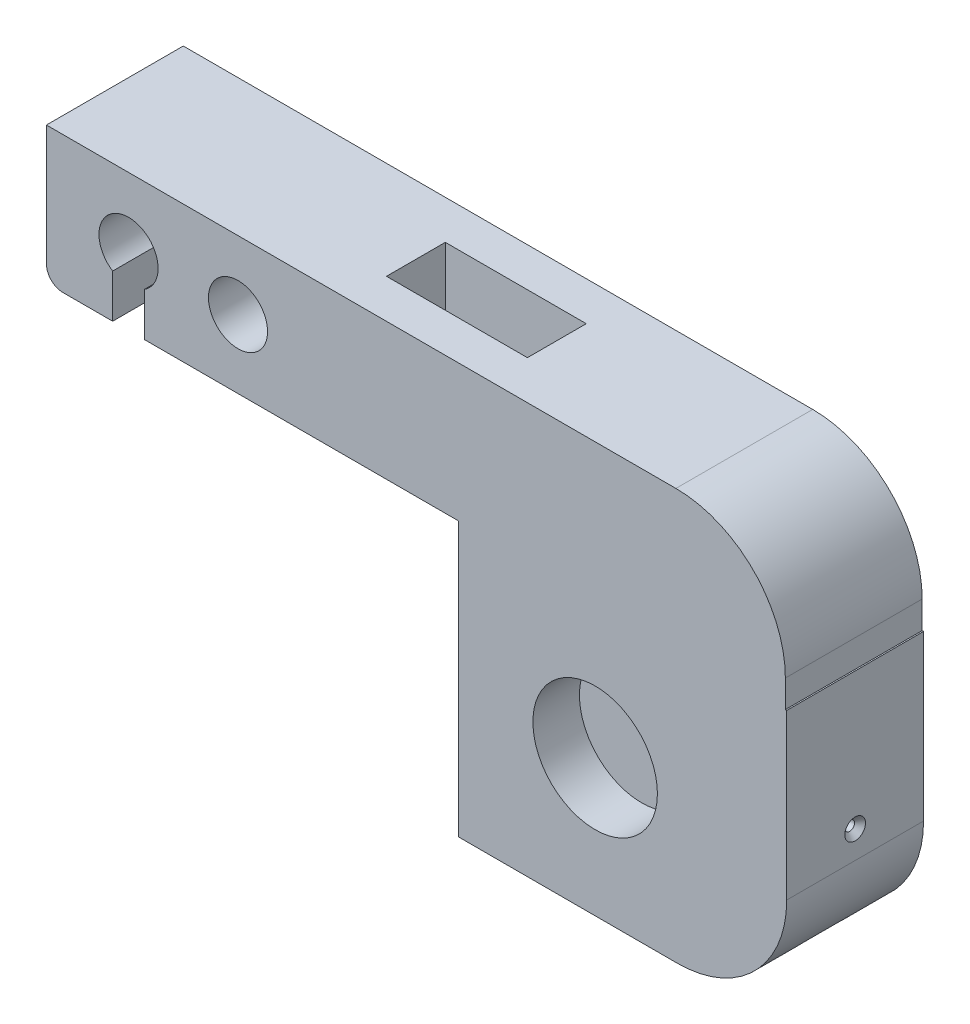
SolidWorks part; units mm, degrees
ref_plane "Front Plane" through (0, 0, 0) normal (0, 0, 1) x (1, 0, 0)
ref_plane "Top Plane" through (0, 0, 0) normal (0, 1, 0) x (1, 0, 0)
ref_plane "Right Plane" through (0, 0, 0) normal (1, 0, 0) x (0, 0, -1)
sketch "Sketch1" plane through (0, 0, 0) normal (0, 0, 1) x (1, 0, 0)
  line L0 (-122.9, 0) -> (-122.9, 7.9448)
  line L1 (0, 0) -> (-135, 0)
  line L2 (0, 0) -> (0, 25)
  line L3 (0, 25) -> (-135, 25)
  line L4 (-135, 0) -> (-135, 25)
  line L5 (-117.1, 0) -> (-117.1, 7.9448)
  circle A0 centre (-120, 12.5) radius 5.4
  circle A1 centre (-100, 12.5) radius 5.4
  dimension "D3" = 15
  dimension "D4" = 12.5
  dimension "D5" = 12.5
  dimension "D6" = 10.8
  dimension "D7" = 35
  dimension "D1" = 25
  dimension "D2" = 135
  dimension "D8" = 5.8
extrude "Boss-Extrude1" add sketch "Sketch1" along normal blind 25 contours A0 L5 L1 L2 L3 L4 L0 A1
sketch "Sketch2" plane through (0, 25, 0) normal (0, 1, 0) x (1, 0, 0)
  line L0 (-69.875, -17.875) -> (-69.875, -25) construction
  line L1 (-80, -7.125) -> (-59.75, -7.125)
  line L2 (-80, -7.125) -> (-80, -17.875)
  line L3 (-80, -17.875) -> (-59.75, -17.875)
  line L4 (-59.75, -7.125) -> (-59.75, -17.875)
  line L5 (0, -25) -> (-135, -25) construction
  line L6 (-69.875, -7.125) -> (-69.875, 0) construction
  line L7 (0, 0) -> (-135, 0) construction
  line L8 (-135, -25) -> (-135, 0) construction
  dimension "D1" = 10.75
  dimension "D2" = 20.25
  dimension "D3" = 55
extrude "Cut-Extrude1" cut sketch "Sketch2" against normal up to surface (25 mm away)
sketch "Sketch3" plane through (0, 0, 0) normal (0, -1, 0) x (1, 0, 0)
  line L0 (0, 25) -> (-117.1, 25) construction
  line L1 (-59.75, 25) -> (0.25, 25)
  line L2 (-59.75, 25) -> (-59.75, 0)
  line L3 (-59.75, 0) -> (0.25, 0)
  line L4 (0.25, 25) -> (0.25, 0)
  line L5 (0, 0) -> (-117.1, 0) construction
  line L6 (-59.75, 17.875) -> (-59.75, 7.125) construction
  dimension "D1" = 60
extrude "Boss-Extrude2" add sketch "Sketch3" along normal blind 50
sketch "Sketch4" plane through (0, -50, 0) normal (0, -1, 0) x (1, 0, 0)
  line L0 (-59.75, 25) -> (-59.75, 0) construction
  line L1 (-59.75, 8.5) -> (-4.75, 8.5)
  line L2 (-59.75, 8.5) -> (-59.75, 16.5)
  line L3 (-59.75, 16.5) -> (-4.75, 16.5)
  line L4 (-4.75, 8.5) -> (-4.75, 16.5)
  line L5 (-32.25, 16.5) -> (-32.25, 25) construction
  line L6 (0.25, 25) -> (-59.75, 25) construction
  line L7 (-32.25, 8.5) -> (-32.25, 0) construction
  line L8 (-59.75, 0) -> (0.25, 0) construction
  dimension "D1" = 8
  dimension "D2" = 55
extrude "Cut-Extrude2" cut sketch "Sketch4" against normal offset from surface (49 mm away) 1
sketch "Sketch5" plane through (0, 0, 25) normal (0, 0, 1) x (1, 0, 0)
  line L0 (-59.75, -50) -> (-59.75, 0) construction
  line L1 (0.25, -50) -> (-59.75, -50) construction
  circle A0 centre (-34.75, -25) radius 11.375
  dimension "D1" = 22.75
  dimension "D2" = 25
  dimension "D3" = 25
extrude "Cut-Extrude3" cut sketch "Sketch5" against normal up to surface (25 mm away) contours A0
sketch "Sketch6" plane through (0, -1, 0) normal (0, -1, 0) x (1, 0, 0)
  line L1 (-59.75, 17.875) -> (-54.25, 17.875)
  line L2 (-59.75, 17.875) -> (-59.75, 7.125)
  line L3 (-59.75, 7.125) -> (-54.25, 7.125)
  line L4 (-54.25, 17.875) -> (-54.25, 7.125)
  line L5 (-80, 17.875) -> (-59.75, 17.875) construction
  line L6 (-59.75, 7.125) -> (-80, 7.125) construction
  line L7 (-59.75, 25) -> (-59.75, 17.875) construction
  dimension "D1" = 5.5
extrude "Cut-Extrude4" cut sketch "Sketch6" against normal through all both and the other way through all
ref_plane "Plane1" through (-59.75, -50, 25) normal (0, 0, -1) x (-1, 0, 0)
sketch "Sketch8" plane through (0.25, 0, 0) normal (1, 0, 0) x (0, 0, -1)
  line L0 (-12.5, -25) -> (-25, -25) construction
  line L1 (-25, -50) -> (-25, 0) construction
  line L2 (-12.5, -25) -> (0, -25) construction
  line L3 (0, -50) -> (0, 0) construction
  circle A0 centre (-12.5, -25) radius 0.89
  point P9 (-25, -25)
  dimension "D1" = 1.78
extrude "Cut-Extrude6" cut sketch "Sketch8" against normal up to surface (5 mm away) contours A0
chamfer "Chamfer1" distance 1 angle 45 1 edges at (0.25, -25, 11.61)
fillet "Fillet1" radius 20 2 edges at (0.25, -50, 12.5) (0, 25, 12.5)
fillet "Fillet2" radius 3 1 edges at (-135, 0, 12.5)
